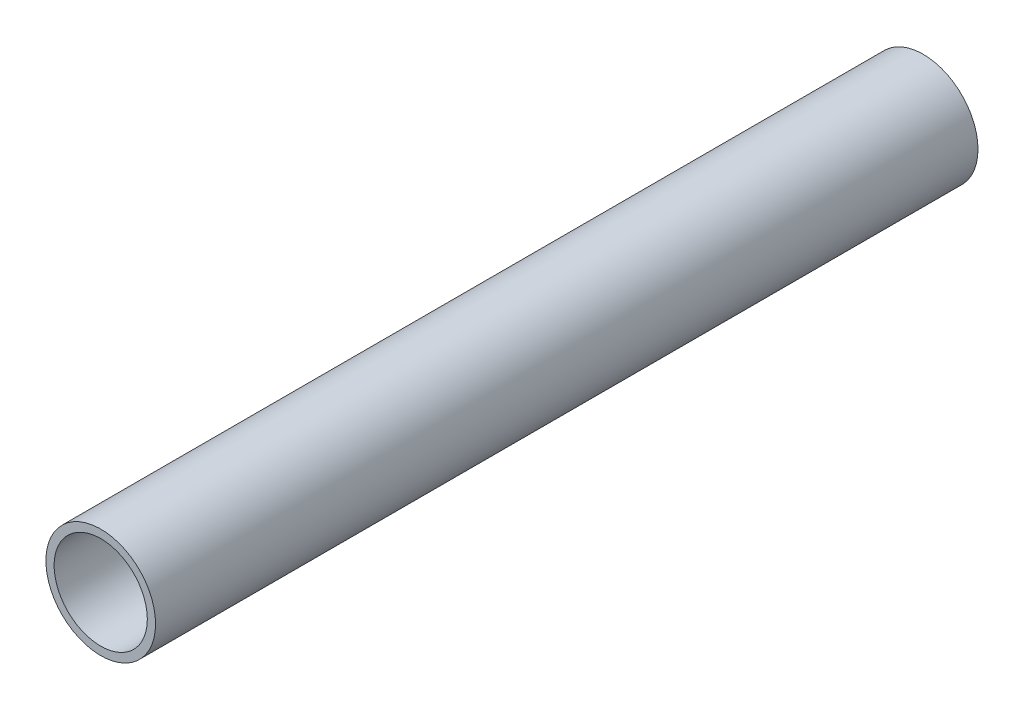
SolidWorks part; units mm, degrees
ref_plane "Face" through (0, 0, 0) normal (0, 0, 1) x (1, 0, 0)
ref_plane "Dessus" through (0, 0, 0) normal (0, 1, 0) x (1, 0, 0)
ref_plane "Droite" through (0, 0, 0) normal (1, 0, 0) x (0, 0, -1)
sketch "Esquisse1" plane through (0, 0, 0) normal (0, 0, 1) x (1, 0, 0)
  circle A0 centre (0, 0) radius 10
  circle A1 centre (0, 0) radius 8.5
  dimension "D1" = 17
  dimension "D2" = 20
extrude "Extrusion1" add sketch "Esquisse1" along normal blind 150
